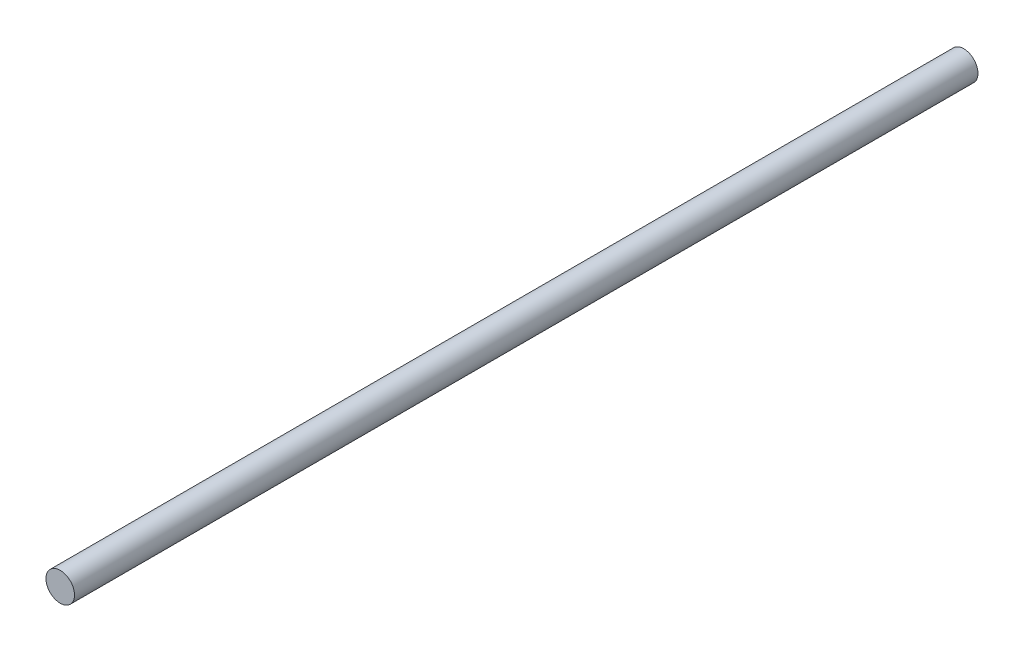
SolidWorks part; units mm, degrees
ref_plane "Front Plane" through (0, 0, 0) normal (0, 0, 1) x (1, 0, 0)
ref_plane "Top Plane" through (0, 0, 0) normal (0, 1, 0) x (1, 0, 0)
ref_plane "Right Plane" through (0, 0, 0) normal (1, 0, 0) x (0, 0, -1)
sketch "Sketch1" plane through (0, 0, 0) normal (0, 0, 1) x (1, 0, 0)
  circle A0 centre (0, 0) radius 30
  dimension "D1" = 60
extrude "Boss-Extrude1" add sketch "Sketch1" against normal blind 1900
